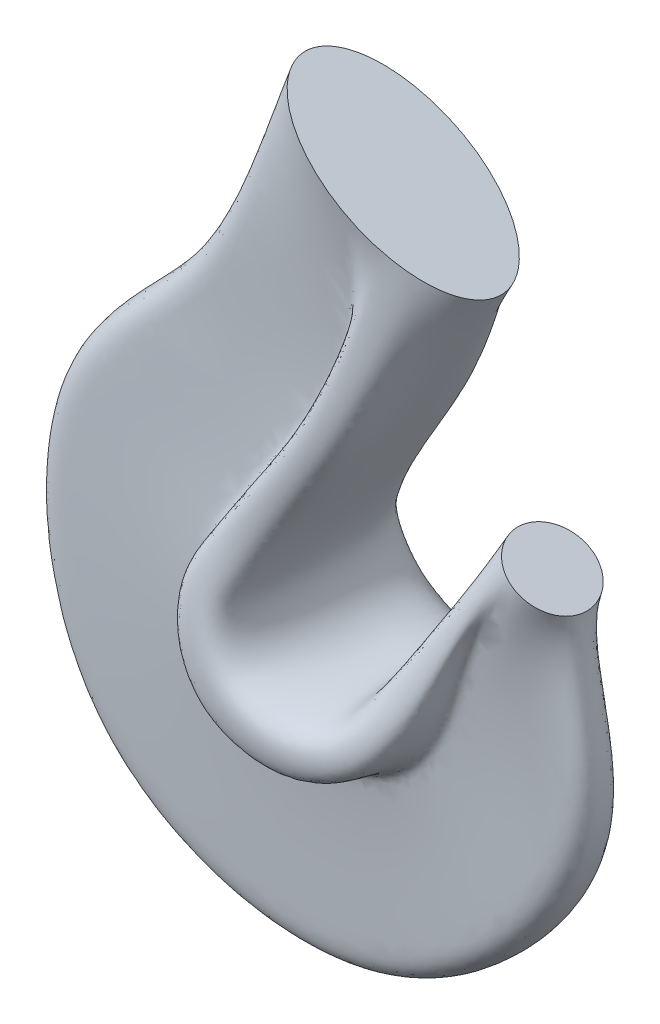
SolidWorks part; units mm, degrees
ref_plane "Front Plane" through (0, 0, 0) normal (0, 0, 1) x (1, 0, 0)
ref_plane "Top Plane" through (0, 0, 0) normal (0, 1, 0) x (1, 0, 0)
ref_plane "Right Plane" through (0, 0, 0) normal (1, 0, 0) x (0, 0, -1)
sketch "Hook Picture" plane through (0, 0, 0) normal (0, 0, 1) x (1, 0, 0)
  circle A0 centre (0, 0) radius 15.875
  dimension "D1" = 31.75
sketch "Hook Contours" plane through (0.053, -0.0979, 0) normal (0, 0, -1) x (-1, 0, 0)
  spline S0 degree 3 poles (-37.0649, -11.0348) (-33.406, -17.3469) (-23.4322, -34.5529) (-10.3758, -57.4401) (1.4723, -77.7839) (7.7336, -88.8425) (10.526, -96.4469) (9.0596, -102.7432) (3.227, -107.6041) (-5.9826, -108.2355) (-11.6869, -101.0235) (-19.561, -88.6039) (-31.2208, -64.4016) (-44.5434, -45.0515) (-52.6215, -33.3186) knots 0 0 0 0 0.105771 0.288319 0.382351 0.446424 0.473781 0.496704 0.535324 0.576409 0.614493 0.659301 0.793419 1 1 1 1
  spline S1 degree 3 poles (6.79, 9.0817) (17.9755, -12.7007) (24.4514, -50.3784) (68.0162, -79.5197) (61.5403, -150.4596) (-11.1658, -170.7703) (-69.7428, -101.3021) (-25.0006, -71.572) (-68.271, -43.0194) knots 0 0 0 0 0.187665 0.310404 0.449466 0.570855 0.727344 1 1 1 1
ref_plane "First Profile Plane" through (26.1585, -30.076, 0) normal (-0.4993, -0.8664, 0) x (-0.8664, 0.4993, 0)
ref_plane "Second Profile Plane" through (7.33, -62.8197, 0) normal (-0.5006, -0.8657, 0) x (-0.8657, 0.5006, 0)
ref_plane "Third Profile Plane" through (-2.4042, -79.6657, 0) normal (-0.497, -0.8677, 0) x (-0.8677, 0.497, 0)
ref_plane "Fourth Profile Plane" through (-8.5007, -91.4382, 0) normal (-0.389, -0.9212, 0) x (-0.9212, 0.389, 0)
ref_plane "Fifth Profile Plane" through (-2.9145, -106.7992, 0) normal (0.9278, -0.3731, 0) x (0, 0, -1)
ref_plane "Sixth Profile Plane" through (11.2604, -101.529, 0) normal (0.584, 0.8117, 0) x (0.8117, -0.584, 0)
ref_plane "Seventh Profile Plane" through (29.5499, -69.3647, 0) normal (0.4874, 0.8732, 0) x (0.8732, -0.4874, 0)
sketch "First Profile" plane through (26.1585, -30.076, 0) normal (-0.4993, -0.8664, 0) x (-0.8664, 0.4993, 0)
  ellipse E0 centre (23.0895, 0) end of major axis (46.179, 0) minor radius 12.7
  dimension "D1" = 25.4
sketch "Second Profile" plane through (7.8492, -63.1199, -0.005) normal (-0.5006, -0.8657, 0) x (0, 0, -1)
  line L4 (-0.005, -0.5998) -> (-0.005, -41.66) construction
  spline S0 degree 3 poles (-0.005, -0.5998) (2.275, -0.5998) (6.2945, -0.5929) (13.5118, -1.5507) (15.3782, -4.4442) (14.984, -9.4172) (10.2878, -10.3403) (6.1023, -10.655) (5.3332, -20.9723) (5.415, -29.1702) (5.1328, -39.0618) (2.9458, -41.4318) (1.3016, -41.66) (-0.005, -41.66) knots 0 0 0 0 0.105066 0.207759 0.289001 0.348754 0.392733 0.478371 0.507138 0.854035 0.919937 0.944739 1 1 1 1 construction
  spline S1 degree 3 poles (-0.005, -0.5998) (-2.2849, -0.5998) (-6.3044, -0.5929) (-13.5217, -1.5507) (-15.3882, -4.4442) (-14.9939, -9.4172) (-10.2978, -10.3403) (-6.1122, -10.655) (-5.3432, -20.9723) (-5.425, -29.1702) (-5.1427, -39.0618) (-2.9558, -41.4318) (-1.3116, -41.66) (-0.005, -41.66) knots 0 0 0 0 0.105066 0.207759 0.289001 0.348754 0.392733 0.478371 0.507138 0.854035 0.919937 0.944739 1 1 1 1 construction
  spline S2 degree 3 poles (-0.005, -0.5998) (-2.2849, -0.5998) (-6.3044, -0.5929) (-13.5217, -1.5507) (-15.3882, -4.4442) (-14.9939, -9.4172) (-10.2978, -10.3403) (-6.1122, -10.655) (-5.3432, -20.9723) (-5.425, -29.1702) (-5.1427, -39.0618) (-2.9558, -41.4318) (-1.3116, -41.66) (-0.005, -41.66) (1.3016, -41.66) (2.9458, -41.4318) (5.1328, -39.0618) (5.415, -29.1702) (5.3332, -20.9723) (6.1023, -10.655) (10.2878, -10.3403) (14.984, -9.4172) (15.3782, -4.4442) (13.5118, -1.5507) (6.2945, -0.5929) (2.275, -0.5998) (-0.005, -0.5998) (-2.2849, -0.5998) (-6.3044, -0.5929) knots -0.052533 0 0 0 0.052533 0.10388 0.144501 0.174377 0.196367 0.239185 0.253569 0.427018 0.459969 0.47237 0.5 0.5 0.5 0.52763 0.540031 0.572982 0.746431 0.760815 0.803633 0.825623 0.855499 0.89612 0.947467 1 1 1 1.052533 1.10388 1.144501 only from (-0.005, -0.5998) to (-0.005, -0.5998)
sketch "Third Profile" plane through (-1.8837, -79.9638, -0.005) normal (-0.497, -0.8677, 0) x (0, 0, -1)
  line L4 (-0.005, -0.5998) -> (-0.005, -43.6903) construction
  spline S0 degree 3 poles (-0.005, -0.5998) (2.3878, -0.5998) (6.606, -0.5926) (14.1801, -1.5977) (16.1389, -4.6342) (15.7252, -9.8532) (10.7968, -10.8219) (6.4043, -11.1522) (5.5972, -21.9796) (5.683, -30.5829) (5.3868, -40.9636) (3.0917, -43.4508) (1.3662, -43.6903) (-0.005, -43.6903) knots 0 0 0 0 0.105066 0.207759 0.289001 0.348754 0.392733 0.478371 0.507138 0.854035 0.919937 0.944739 1 1 1 1 construction
  spline S1 degree 3 poles (-0.005, -0.5998) (-2.3977, -0.5998) (-6.6159, -0.5926) (-14.19, -1.5977) (-16.1488, -4.6342) (-15.7351, -9.8532) (-10.8067, -10.8219) (-6.4142, -11.1522) (-5.6071, -21.9796) (-5.693, -30.5829) (-5.3967, -40.9636) (-3.1017, -43.4508) (-1.3762, -43.6903) (-0.005, -43.6903) knots 0 0 0 0 0.105066 0.207759 0.289001 0.348754 0.392733 0.478371 0.507138 0.854035 0.919937 0.944739 1 1 1 1 construction
  spline S2 degree 3 poles (-0.005, -0.5998) (-2.3977, -0.5998) (-6.6159, -0.5926) (-14.19, -1.5977) (-16.1488, -4.6342) (-15.7351, -9.8532) (-10.8067, -10.8219) (-6.4142, -11.1522) (-5.6071, -21.9796) (-5.693, -30.5829) (-5.3967, -40.9636) (-3.1017, -43.4508) (-1.3762, -43.6903) (-0.005, -43.6903) (1.3662, -43.6903) (3.0917, -43.4508) (5.3868, -40.9636) (5.683, -30.5829) (5.5972, -21.9796) (6.4043, -11.1522) (10.7968, -10.8219) (15.7252, -9.8532) (16.1389, -4.6342) (14.1801, -1.5977) (6.606, -0.5926) (2.3878, -0.5998) (-0.005, -0.5998) (-2.3977, -0.5998) (-6.6159, -0.5926) knots -0.052533 0 0 0 0.052533 0.10388 0.144501 0.174377 0.196367 0.239185 0.253569 0.427018 0.459969 0.47237 0.5 0.5 0.5 0.52763 0.540031 0.572982 0.746431 0.760815 0.803633 0.825623 0.855499 0.89612 0.947467 1 1 1 1.052533 1.10388 1.144501 only from (-0.005, -0.5998) to (-0.005, -0.5998)
sketch "Fourth Profile" plane through (-7.9481, -91.6716, -0.005) normal (-0.389, -0.9212, 0) x (0, 0, -1)
  line L4 (-0.005, -0.5998) -> (-0.005, -48.7005) construction
  spline S0 degree 3 poles (-0.005, -0.5998) (2.666, -0.5998) (7.3747, -0.5917) (15.8294, -1.7137) (18.0159, -5.1033) (17.5541, -10.9291) (12.0527, -12.0104) (7.1495, -12.3791) (6.2486, -24.4655) (6.3444, -34.069) (6.0137, -45.6568) (3.4518, -48.4332) (1.5257, -48.7005) (-0.005, -48.7005) knots 0 0 0 0 0.105066 0.207759 0.289001 0.348754 0.392733 0.478371 0.507138 0.854035 0.919937 0.944739 1 1 1 1 construction
  spline S1 degree 3 poles (-0.005, -0.5998) (-2.6759, -0.5998) (-7.3846, -0.5917) (-15.8394, -1.7137) (-18.0259, -5.1033) (-17.5641, -10.9291) (-12.0626, -12.0104) (-7.1594, -12.3791) (-6.2585, -24.4655) (-6.3543, -34.069) (-6.0236, -45.6568) (-3.4617, -48.4332) (-1.5356, -48.7005) (-0.005, -48.7005) knots 0 0 0 0 0.105066 0.207759 0.289001 0.348754 0.392733 0.478371 0.507138 0.854035 0.919937 0.944739 1 1 1 1 construction
  spline S2 degree 3 poles (-0.005, -0.5998) (-2.6759, -0.5998) (-7.3846, -0.5917) (-15.8394, -1.7137) (-18.0259, -5.1033) (-17.5641, -10.9291) (-12.0626, -12.0104) (-7.1594, -12.3791) (-6.2585, -24.4655) (-6.3543, -34.069) (-6.0236, -45.6568) (-3.4617, -48.4332) (-1.5356, -48.7005) (-0.005, -48.7005) (1.5257, -48.7005) (3.4518, -48.4332) (6.0137, -45.6568) (6.3444, -34.069) (6.2486, -24.4655) (7.1495, -12.3791) (12.0527, -12.0104) (17.5541, -10.9291) (18.0159, -5.1033) (15.8294, -1.7137) (7.3747, -0.5917) (2.666, -0.5998) (-0.005, -0.5998) (-2.6759, -0.5998) (-7.3846, -0.5917) knots -0.052533 0 0 0 0.052533 0.10388 0.144501 0.174377 0.196367 0.239185 0.253569 0.427018 0.459969 0.47237 0.5 0.5 0.5 0.52763 0.540031 0.572982 0.746431 0.760815 0.803633 0.825623 0.855499 0.89612 0.947467 1 1 1 1.052533 1.10388 1.144501 only from (-0.005, -0.5998) to (-0.005, -0.5998)
sketch "Fifth Profile" plane through (-2.9126, -106.7946, 0.5998) normal (0.9278, -0.3731, 0) x (0.3731, 0.9278, 0)
  line L4 (-0.005, -0.5998) -> (-56.0362, -0.5998) construction
  spline S0 degree 3 poles (-0.005, -0.5998) (-0.005, -3.7111) (0.0044, -9.1961) (-1.3025, -19.0449) (-5.251, -21.5918) (-12.0373, -21.0539) (-13.2969, -14.6454) (-13.7264, -8.9338) (-27.8055, -7.8844) (-38.9924, -7.996) (-52.4906, -7.6108) (-55.7248, -4.6265) (-56.0362, -2.3828) (-56.0362, -0.5998) knots 0 0 0 0 0.105066 0.207759 0.289001 0.348754 0.392733 0.478371 0.507138 0.854035 0.919937 0.944739 1 1 1 1 construction
  spline S1 degree 3 poles (-0.005, -0.5998) (-0.005, 2.5115) (0.0044, 7.9966) (-1.3025, 17.8453) (-5.251, 20.3923) (-12.0373, 19.8543) (-13.2969, 13.4459) (-13.7264, 7.7342) (-27.8055, 6.6848) (-38.9924, 6.7964) (-52.4906, 6.4112) (-55.7248, 3.4269) (-56.0362, 1.1832) (-56.0362, -0.5998) knots 0 0 0 0 0.105066 0.207759 0.289001 0.348754 0.392733 0.478371 0.507138 0.854035 0.919937 0.944739 1 1 1 1 construction
  spline S2 degree 3 poles (-0.005, -0.5998) (-0.005, 2.5115) (0.0044, 7.9966) (-1.3025, 17.8453) (-5.251, 20.3923) (-12.0373, 19.8543) (-13.2969, 13.4459) (-13.7264, 7.7342) (-27.8055, 6.6848) (-38.9924, 6.7964) (-52.4906, 6.4112) (-55.7248, 3.4269) (-56.0362, 1.1832) (-56.0362, -0.5998) (-56.0362, -2.3828) (-55.7248, -4.6265) (-52.4906, -7.6108) (-38.9924, -7.996) (-27.8055, -7.8844) (-13.7264, -8.9338) (-13.2969, -14.6454) (-12.0373, -21.0539) (-5.251, -21.5918) (-1.3025, -19.0449) (0.0044, -9.1961) (-0.005, -3.7111) (-0.005, -0.5998) (-0.005, 2.5115) (0.0044, 7.9966) knots -0.052533 0 0 0 0.052533 0.10388 0.144501 0.174377 0.196367 0.239185 0.253569 0.427018 0.459969 0.47237 0.5 0.5 0.5 0.52763 0.540031 0.572982 0.746431 0.760815 0.803633 0.825623 0.855499 0.89612 0.947467 1 1 1 1.052533 1.10388 1.144501 only from (-0.005, -0.5998) to (-0.005, -0.5998)
sketch "Sixth Profile" plane through (10.7735, -101.1787, -0.005) normal (0.584, 0.8117, 0) x (0, 0, -1)
  line L4 (-0.005, -0.5998) -> (-0.005, -40.3248) construction
  spline S0 degree 3 poles (-0.005, -0.5998) (2.2009, -0.5998) (6.0897, -0.5931) (13.0722, -1.5197) (14.878, -4.3191) (14.4966, -9.1305) (9.9531, -10.0235) (5.9037, -10.328) (5.1597, -20.3098) (5.2388, -28.2411) (4.9657, -37.8111) (2.8499, -40.104) (1.2592, -40.3248) (-0.005, -40.3248) knots 0 0 0 0 0.105066 0.207759 0.289001 0.348754 0.392733 0.478371 0.507138 0.854035 0.919937 0.944739 1 1 1 1 construction
  spline S1 degree 3 poles (-0.005, -0.5998) (-2.2108, -0.5998) (-6.0996, -0.5931) (-13.0822, -1.5197) (-14.8879, -4.3191) (-14.5065, -9.1305) (-9.9631, -10.0235) (-5.9136, -10.328) (-5.1696, -20.3098) (-5.2487, -28.2411) (-4.9756, -37.8111) (-2.8598, -40.104) (-1.2691, -40.3248) (-0.005, -40.3248) knots 0 0 0 0 0.105066 0.207759 0.289001 0.348754 0.392733 0.478371 0.507138 0.854035 0.919937 0.944739 1 1 1 1 construction
  spline S2 degree 3 poles (-0.005, -0.5998) (-2.2108, -0.5998) (-6.0996, -0.5931) (-13.0822, -1.5197) (-14.8879, -4.3191) (-14.5065, -9.1305) (-9.9631, -10.0235) (-5.9136, -10.328) (-5.1696, -20.3098) (-5.2487, -28.2411) (-4.9756, -37.8111) (-2.8598, -40.104) (-1.2691, -40.3248) (-0.005, -40.3248) (1.2592, -40.3248) (2.8499, -40.104) (4.9657, -37.8111) (5.2388, -28.2411) (5.1597, -20.3098) (5.9037, -10.328) (9.9531, -10.0235) (14.4966, -9.1305) (14.878, -4.3191) (13.0722, -1.5197) (6.0897, -0.5931) (2.2009, -0.5998) (-0.005, -0.5998) (-2.2108, -0.5998) (-6.0996, -0.5931) knots -0.052533 0 0 0 0.052533 0.10388 0.144501 0.174377 0.196367 0.239185 0.253569 0.427018 0.459969 0.47237 0.5 0.5 0.5 0.52763 0.540031 0.572982 0.746431 0.760815 0.803633 0.825623 0.855499 0.89612 0.947467 1 1 1 1.052533 1.10388 1.144501 only from (-0.005, -0.5998) to (-0.005, -0.5998)
sketch "Seventh Profile" plane through (29.5499, -69.3647, 0) normal (0.4874, 0.8732, 0) x (0.8732, -0.4874, 0)
  ellipse E0 centre (8.0557, 0) end of major axis (16.1114, 0) minor radius 7.62
  dimension "D1" = 15.24
other "Hook Body"
